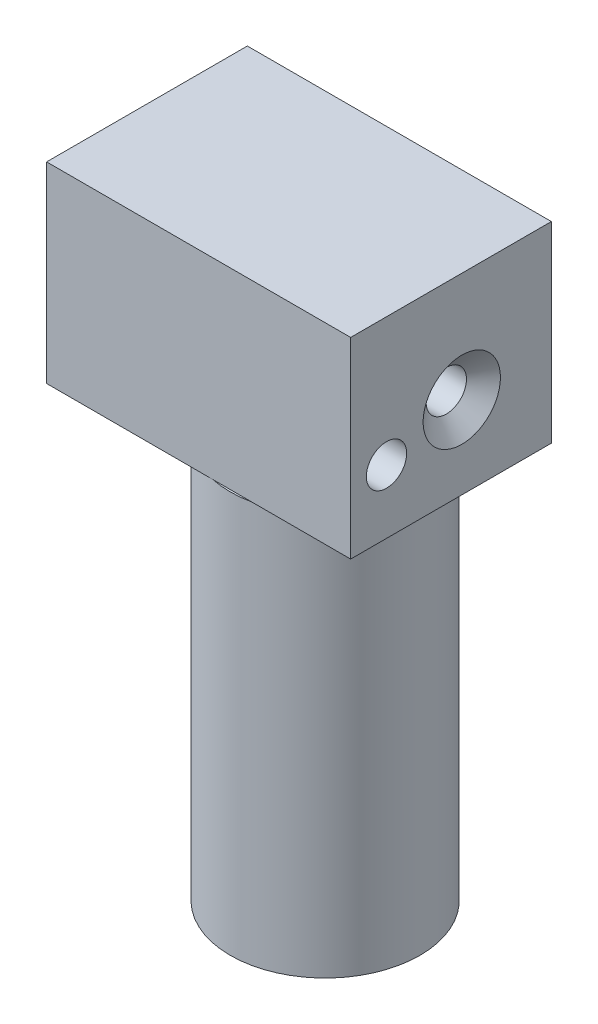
SolidWorks part; units mm, degrees
ref_plane "Front Plane" through (0, 0, 0) normal (0, 0, 1) x (1, 0, 0)
ref_plane "Top Plane" through (0, 0, 0) normal (0, 1, 0) x (1, 0, 0)
ref_plane "Right Plane" through (0, 0, 0) normal (1, 0, 0) x (0, 0, -1)
sketch "Sketch1" plane through (0, 0, 0) normal (0, 0, 1) x (1, 0, 0)
  line L1 (-8.7361, -5.4447) -> (29.7403, -5.4447)
  line L2 (-8.7361, -5.4447) -> (-8.7361, 18.8497)
  line L3 (-8.7361, 18.8497) -> (29.7403, 18.8497)
  line L4 (29.7403, -5.4447) -> (29.7403, 18.8497)
extrude "Extrude1" add sketch "Sketch1" along normal blind 25.4
sketch "Sketch4" plane through (0, -5.4447, 0) normal (0, -1, 0) x (1, 0, 0)
  circle A0 centre (14.7616, 13.6555) radius 12.0013
extrude "Extrude2" add sketch "Sketch4" along normal blind 50.8
ref_plane "Plane1" through (8.172, 0, 0) normal (1, 0, 0) x (0, 0, -1)
hole_wizard "CSK for #10 Flat Head Machine Screw (100)1" positions "Sketch10" profile "Sketch9" countersink size "#10" standard "Ansi Inch"
sketch "Sketch10" plane through (29.7403, 0, 0) normal (1, 0, 0) x (0, 0, -1)
  point P0 (-11.3361, 4.9882)
sketch "Sketch9" plane through (29.7403, 4.9882, 11.3361) normal (0, 1, 0) x (0, 0, -1)
  line L0 (0, 0) -> (0, 38.4764)
  line L1 (0, 38.4764) -> (2.5527, 38.4764)
  line L2 (2.5527, 38.4764) -> (2.5527, 1.9608)
  line L3 (2.5527, 1.9608) -> (4.8895, 0)
  line L5 (4.8895, 0) -> (0, 0)
  line L6 (-2.5527, 1.9608) -> (-4.8895, 0) construction
  line L11 (0, -6.35) -> (0, 107.95) construction
  dimension "Thru Hole Dia." = 5.1054
  dimension "Thru Hole Depth" = 38.4764
  dimension "Near C'Sink Dia." = 9.779
  dimension "Near C'Sink Angle" = 100
hole_wizard "1/4-20 Tapped Hole1" positions "Sketch12" profile "Sketch11" tap size "1/4-20" standard "Example Inch"
sketch "Sketch12" plane through (29.7403, 0, 0) normal (1, 0, 0) x (0, 0, -1)
  circle A0 centre (-11.3361, 4.9882) radius 4.8895 construction
  point P0 (-20.8611, 2.6069)
  dimension "D1" = 2.3813
  dimension "D2" = 9.525
sketch "Sketch11" plane through (29.7403, 2.6069, 20.8611) normal (0, 1, 0) x (0, 0, -1)
  line L0 (0, 0) -> (0, 20.5838)
  line L1 (0, 20.5838) -> (2.5527, 19.05)
  line L2 (2.5527, 19.05) -> (2.5527, 0)
  line L5 (2.5527, 0) -> (0, 0)
  line L10 (0, 20.5838) -> (-2.5527, 19.05) construction
  line L11 (0, -6.35) -> (0, 107.95) construction
  dimension "Tap Drill Dia." = 5.1054
  dimension "Tap Drill Depth" = 19.05
  dimension "Drill Angle" = 118
